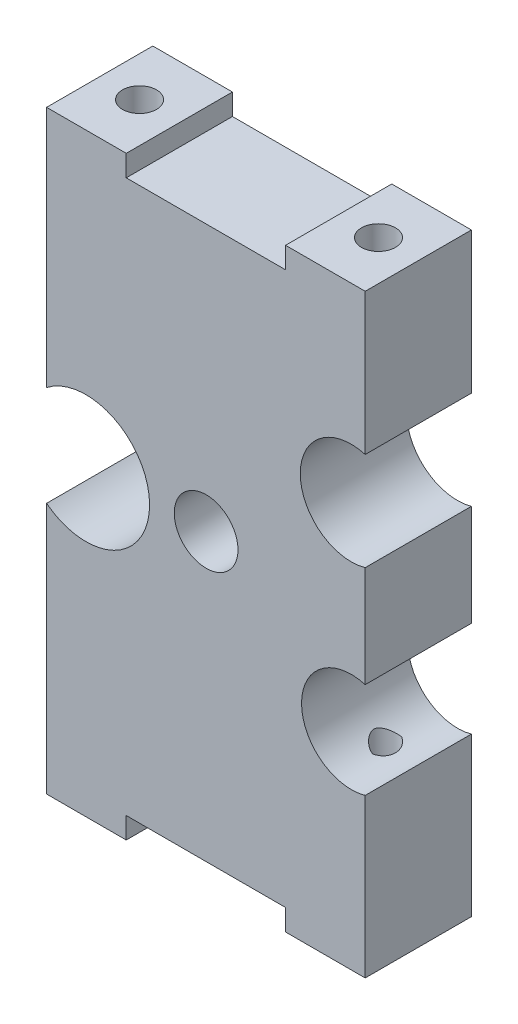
SolidWorks part; units mm, degrees
ref_plane "Piano frontale" through (0, 0, 0) normal (0, 0, 1) x (1, 0, 0)
ref_plane "Piano superiore" through (0, 0, 0) normal (0, 1, 0) x (1, 0, 0)
ref_plane "Piano destro" through (0, 0, 0) normal (1, 0, 0) x (0, 0, -1)
sketch "Schizzo1" plane through (0, 0, 0) normal (0, 0, 1) x (1, 0, 0)
  line L84 (-29.7378, 8.9033) -> (-29.7378, 54.6109)
  line L85 (-29.7378, 54.6109) -> (-14.7378, 54.6109)
  line L86 (-14.7378, 54.6109) -> (-14.7378, 50.6109)
  line L87 (-14.7378, 50.6109) -> (15.2622, 50.6109)
  line L88 (15.2622, 50.6109) -> (15.2622, 54.6109)
  line L89 (15.2622, 54.6109) -> (30.2622, 54.6109)
  line L90 (30.2622, 54.6109) -> (30.2622, 27.9914)
  line L121 (30.2622, 9.5356) -> (30.2622, -9.5435)
  line L152 (30.2622, -27.6072) -> (30.2622, -57.3891)
  line L153 (30.2622, -57.3891) -> (15.2622, -57.3891)
  line L154 (15.2622, -57.3891) -> (15.2622, -53.3891)
  line L155 (15.2622, -53.3891) -> (-14.7378, -53.3891)
  line L156 (-14.7378, -53.3891) -> (-14.7378, -57.3891)
  line L157 (-14.7378, -57.3891) -> (-29.7378, -57.3891)
  line L158 (-29.7378, -57.3891) -> (-29.7378, -9.9695)
  arc A0 (-29.7378, 8.9033) -> (-29.7378, -9.9695) centre (-22.3356, -0.5331) cw
  arc A1 (30.2622, 27.9914) -> (30.2622, 9.5356) centre (27.6334, 18.7635) ccw
  arc A2 (30.2622, -27.6072) -> (30.2622, -9.5435) centre (27.6707, -18.5753) cw
  circle A3 centre (0.3014, 0.4584) radius 6
  dimension "D1" = 4
  dimension "D2" = 4
  dimension "D3" = 112
  dimension "D4" = 104
extrude "Estrusione-Estrusione1" add sketch "Schizzo1" along normal blind 20
sketch "Schizzo2" plane through (0, -57.3891, 0) normal (0, -1, 0) x (-1, 0, 0)
  point P0 (22.2378, -10)
  point P4 (-22.7622, -10)
hole_wizard "Foro per Vite M6-1" positions "Schizzo4" profile "Schizzo3" hole size "M6" standard "ISO"
sketch "Schizzo4" plane through (0, -57.3891, 0) normal (0, -1, 0) x (-1, 0, 0)
  point P0 (22.2378, -10)
sketch "Schizzo3" plane through (-22.2378, -57.3891, 10) normal (1, 0, 0) x (0, 0, -1)
  line L0 (0, 0) -> (0, 31.9228)
  line L1 (0, 31.9228) -> (3.2, 30)
  line L2 (3.2, 30) -> (3.2, 0)
  line L5 (3.2, 0) -> (0, 0)
  line L10 (0, 31.9228) -> (-3.2, 30) construction
  line L11 (0, -6.35) -> (0, 107.95) construction
  dimension "Hole Dia." = 6.4
  dimension "Hole Depth" = 30
  dimension "Drill Angle" = 118
hole_wizard "Foro per Vite M6-2" positions "Schizzo6" profile "Schizzo5" hole size "M6" standard "ISO"
sketch "Schizzo6" plane through (0, -57.3891, 0) normal (0, -1, 0) x (-1, 0, 0)
  point P0 (-22.7622, -10)
sketch "Schizzo5" plane through (22.7622, -57.3891, 10) normal (1, 0, 0) x (0, 0, -1)
  line L0 (0, 0) -> (0, 31.9228)
  line L1 (0, 31.9228) -> (3.2, 30)
  line L2 (3.2, 30) -> (3.2, 0)
  line L5 (3.2, 0) -> (0, 0)
  line L10 (0, 31.9228) -> (-3.2, 30) construction
  line L11 (0, -6.35) -> (0, 107.95) construction
  dimension "Hole Dia." = 6.4
  dimension "Hole Depth" = 30
  dimension "Drill Angle" = 118
hole_wizard "Foro per Vite M6-4" positions "Schizzo10" profile "Schizzo9" hole size "M6" standard "ISO"
sketch "Schizzo10" plane through (0, 54.6109, 0) normal (0, 1, 0) x (1, 0, 0)
  point P0 (-22.2378, -10)
  point P3 (22.7622, -10)
sketch "Schizzo9" plane through (-22.2378, 54.6109, 10) normal (1, 0, 0) x (0, 0, 1)
  line L0 (0, 0) -> (0, 31.9228)
  line L1 (0, 31.9228) -> (3.2, 30)
  line L2 (3.2, 30) -> (3.2, 0)
  line L5 (3.2, 0) -> (0, 0)
  line L10 (0, 31.9228) -> (-3.2, 30) construction
  line L11 (0, -6.35) -> (0, 107.95) construction
  dimension "Hole Dia." = 6.4
  dimension "Hole Depth" = 30
  dimension "Drill Angle" = 118
